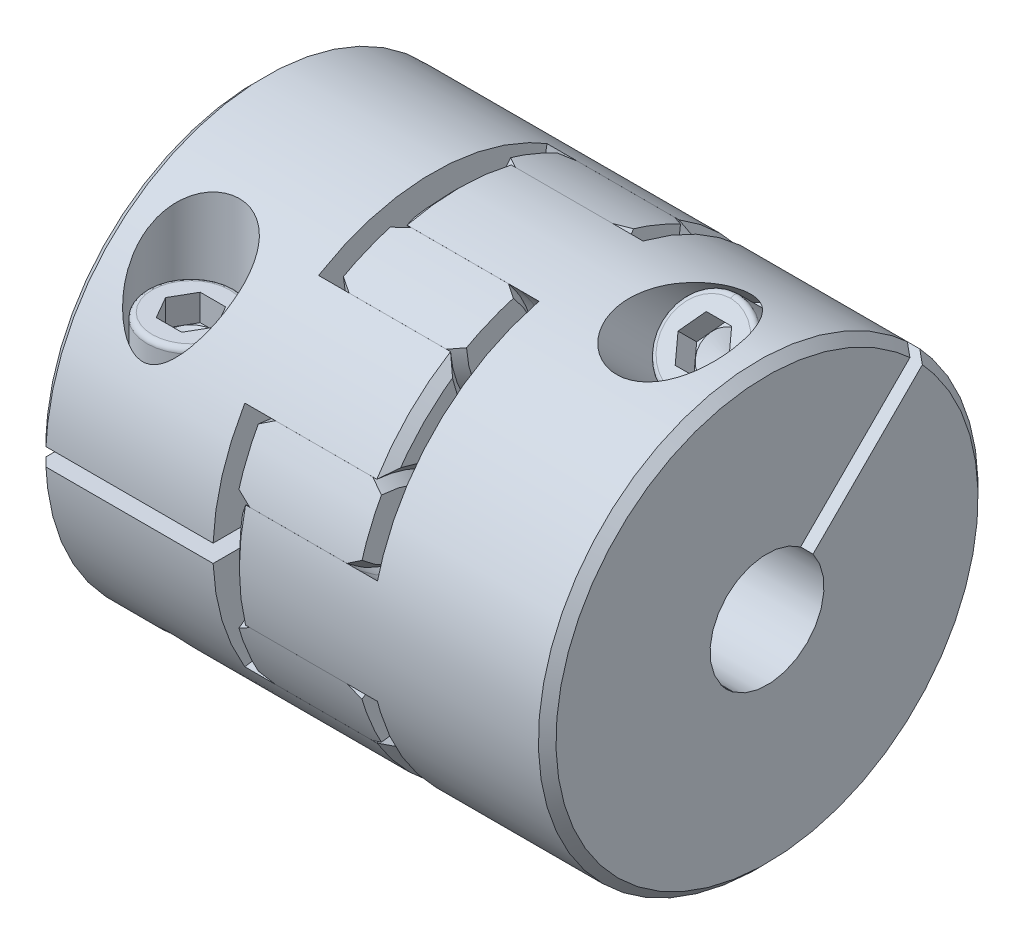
SolidWorks part; units mm, degrees
ref_plane "Front Plane" through (0, 0, 0) normal (0, 0, 1) x (1, 0, 0)
ref_plane "Top Plane" through (0, 0, 0) normal (0, 1, 0) x (1, 0, 0)
ref_plane "Right Plane" through (0, 0, 0) normal (1, 0, 0) x (0, 0, -1)
imported_body "Imported1"
sketch "Sketch1" plane through (36, 0, 0) normal (1, 0, 0) x (0, 0, -1)
  line L0 (-9.5671, -23.097) -> (0, 0) construction
  arc A0 (-12.9837, -21.364) -> (-8.7765, -12.7759) centre (0, -22.4) cw
  arc A1 (-12.6234, -19.1906) -> (-12.9837, -21.364) centre (0, -22.4) ccw construction
  arc A2 (-8.7349, -12.8044) -> (-7.977, -13.2897) centre (0, 0) ccw construction
  arc A4 (-12.9837, -21.364) -> (-5.9258, -24.2876) centre (0, 0) ccw
  arc A6 (-24.98, -1) -> (-24.98, 1) centre (0, 0) ccw construction
  arc A7 (-5.9258, -24.2876) -> (-2.828, -15.2398) centre (-15.8392, -15.8392) ccw
  arc A8 (-8.7765, -12.7759) -> (-12.8044, -8.7349) centre (0, 0) cw
  arc A9 (-13.2897, -7.977) -> (-7.977, -13.2897) centre (0, 0) ccw construction
  arc A10 (-15.2398, -2.828) -> (-15.2305, 2.8776) centre (0, 0) cw
  arc A11 (-24.2876, -5.9258) -> (-15.2398, -2.828) centre (-15.8392, -15.8392) cw
  arc A12 (-24.2876, -5.9258) -> (-21.364, -12.9837) centre (0, 0) ccw
  arc A13 (-21.364, -12.9837) -> (-12.7759, -8.7765) centre (-22.4, 0) ccw
  arc A14 (-12.7759, 8.7765) -> (-8.7349, 12.8044) centre (0, 0) cw
  arc A15 (-21.364, 12.9837) -> (-12.7759, 8.7765) centre (-22.4, 0) cw
  arc A16 (-21.364, 12.9837) -> (-24.2876, 5.9258) centre (0, 0) ccw
  arc A17 (-24.2876, 5.9258) -> (-15.2398, 2.828) centre (-15.8392, 15.8392) ccw
  arc A18 (-2.828, 15.2398) -> (2.8776, 15.2305) centre (0, 0) cw
  arc A19 (-5.9258, 24.2876) -> (-2.828, 15.2398) centre (-15.8392, 15.8392) cw
  arc A20 (-5.9258, 24.2876) -> (-12.9837, 21.364) centre (0, 0) ccw
  arc A21 (-12.9837, 21.364) -> (-8.7765, 12.7759) centre (0, 22.4) ccw
  arc A22 (8.7765, 12.7759) -> (12.8044, 8.7349) centre (0, 0) cw
  arc A23 (12.9837, 21.364) -> (8.7765, 12.7759) centre (0, 22.4) cw
  arc A24 (12.9837, 21.364) -> (5.9258, 24.2876) centre (0, 0) ccw
  arc A25 (5.9258, 24.2876) -> (2.828, 15.2398) centre (15.8392, 15.8392) ccw
  arc A26 (15.2398, 2.828) -> (15.2305, -2.8776) centre (0, 0) cw
  arc A27 (24.2876, 5.9258) -> (15.2398, 2.828) centre (15.8392, 15.8392) cw
  arc A28 (24.2876, 5.9258) -> (21.364, 12.9837) centre (0, 0) ccw
  arc A29 (21.364, 12.9837) -> (12.7759, 8.7765) centre (22.4, 0) ccw
  arc A30 (12.7759, -8.7765) -> (8.7349, -12.8044) centre (0, 0) cw
  arc A31 (21.364, -12.9837) -> (12.7759, -8.7765) centre (22.4, 0) cw
  arc A32 (21.364, -12.9837) -> (24.2876, -5.9258) centre (0, 0) ccw
  arc A33 (24.2876, -5.9258) -> (15.2398, -2.828) centre (15.8392, -15.8392) ccw
  arc A34 (2.828, -15.2398) -> (-2.8776, -15.2305) centre (0, 0) cw
  arc A35 (5.9258, -24.2876) -> (2.828, -15.2398) centre (15.8392, -15.8392) cw
  arc A36 (5.9258, -24.2876) -> (12.9837, -21.364) centre (0, 0) ccw
  arc A37 (12.9837, -21.364) -> (8.7765, -12.7759) centre (0, -22.4) ccw
  point P79 (0, 0)
  dimension "D1" = 8
extrude "Cut-Extrude-Thin1" cut sketch "Sketch1" against normal up to surface (14 mm away) thin
